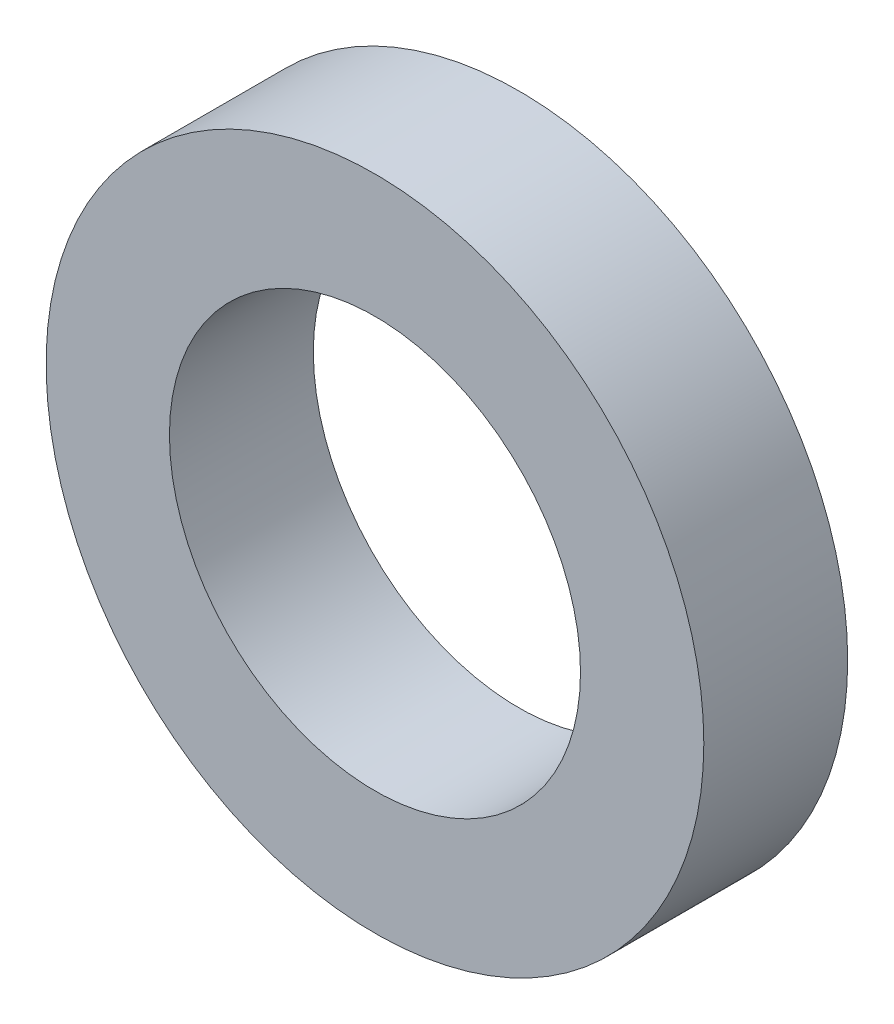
SolidWorks part; units mm, degrees
ref_plane "前视基准面" through (0, 0, 0) normal (0, 0, 1) x (1, 0, 0)
ref_plane "上视基准面" through (0, 0, 0) normal (0, 1, 0) x (1, 0, 0)
ref_plane "右视基准面" through (0, 0, 0) normal (1, 0, 0) x (0, 0, -1)
other "Configuration Table"
sketch "草图1" plane through (0, 0, 0) normal (0, 0, 1) x (1, 0, 0)
  circle A0 centre (0, 0) radius 10
  circle A1 centre (0, 0) radius 16
  dimension "D1" = 32
  dimension "D2" = 20
extrude "凸台-拉伸1" add sketch "草图1" along normal blind 7
